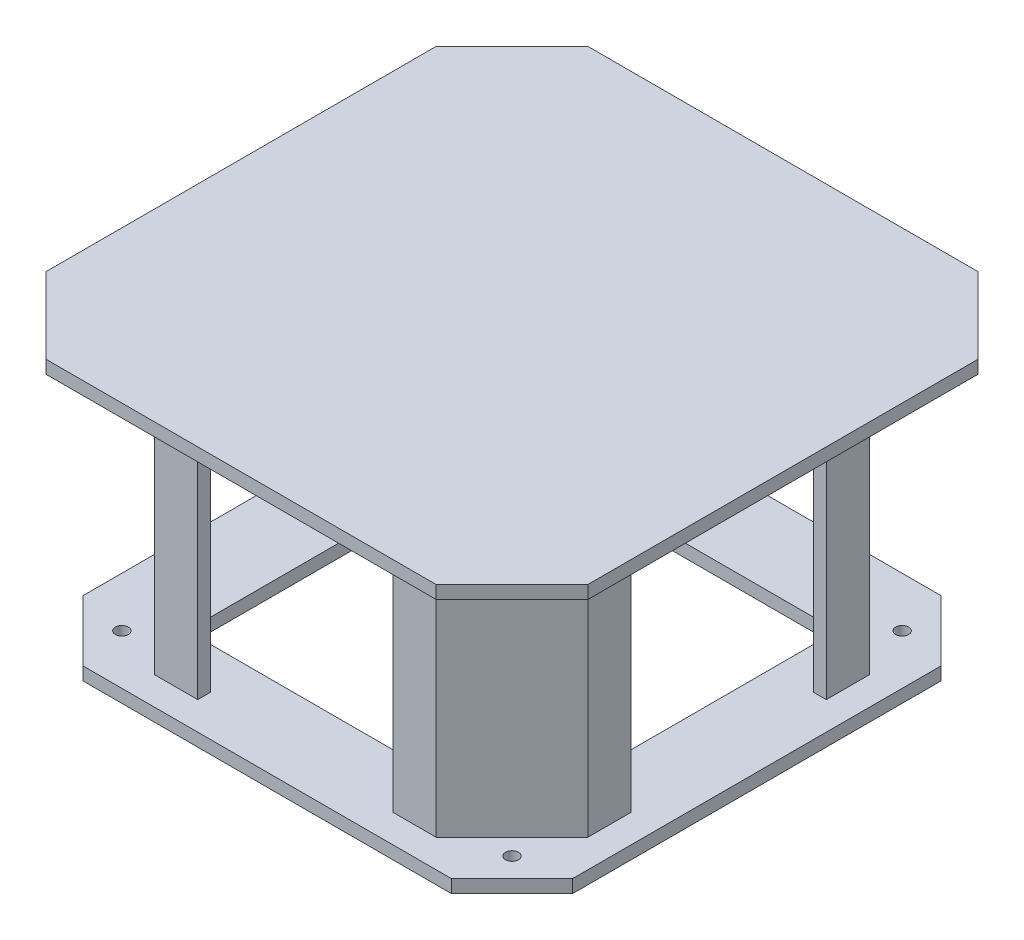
SolidWorks part; units mm, degrees
ref_plane "Front Plane" through (0, 0, 0) normal (0, 0, 1) x (1, 0, 0)
ref_plane "Top Plane" through (0, 0, 0) normal (0, 1, 0) x (1, 0, 0)
ref_plane "Right Plane" through (0, 0, 0) normal (1, 0, 0) x (0, 0, -1)
sketch "Sketch1" plane through (0, 0, 0) normal (0, 1, 0) x (1, 0, 0)
  line L1 (-125, -125) -> (125, -125)
  line L2 (-125, -125) -> (-125, 125)
  line L3 (-125, 125) -> (125, 125)
  line L4 (125, -125) -> (125, 125)
  line L5 (-125, -125) -> (125, 125) construction
  line L6 (-125, 125) -> (125, -125) construction
  point P0 (0, 0)
  dimension "D1" = 250
extrude "Boss-Extrude1" add sketch "Sketch1" along normal blind 6
chamfer "Chamfer1" distance 35 angle 45 4 edges at (-125, 3, -125) (125, 3, -125) (125, 3, 125) (-125, 3, 125)
sketch "Sketch3" plane through (0, 0, 0) normal (0, -1, 0) x (1, 0, 0)
  line L0 (-100, 65) -> (-65, 100)
  line L1 (-65, -100) -> (-45, -100)
  line L2 (-100, -65) -> (-100, -45)
  line L3 (-65, 100) -> (-45, 100)
  line L4 (100, -65) -> (100, -45)
  line L5 (-94, 45) -> (-94, 62.5147)
  line L6 (-94, 62.5147) -> (-62.5147, 94)
  line L7 (-100, -65) -> (-65, -100)
  line L8 (65, -100) -> (100, -65)
  line L9 (65, 100) -> (100, 65)
  line L10 (-100, 45) -> (-100, 65)
  line L11 (-62.5147, 94) -> (-45, 94)
  line L12 (-94, -62.5147) -> (-94, -45)
  line L13 (-94, -62.5147) -> (-62.5147, -94)
  line L14 (-62.5147, -94) -> (-45, -94)
  line L15 (45, -94) -> (62.5147, -94)
  line L16 (62.5147, -94) -> (94, -62.5147)
  line L17 (94, -62.5147) -> (94, -45)
  line L18 (45, 94) -> (62.5147, 94)
  line L19 (62.5147, 94) -> (94, 62.5147)
  line L20 (94, 45) -> (94, 62.5147)
  line L21 (-100, 45) -> (-94, 45)
  line L22 (-45, 100) -> (-45, 94)
  line L23 (45, 100) -> (45, 94)
  line L24 (94, 45) -> (100, 45)
  line L25 (100, 45) -> (100, 65)
  line L26 (94, -45) -> (100, -45)
  line L27 (45, 100) -> (65, 100)
  line L28 (45, -94) -> (45, -100)
  line L29 (45, -100) -> (65, -100)
  line L30 (-45, -100) -> (-45, -94)
  line L31 (-100, -45) -> (-94, -45)
  point P0 (0, 0)
  point P14 (0, 0)
  point P19 (0, 0)
  dimension "D1" = 20
  dimension "D2" = 100
  dimension "D3" = 100
  dimension "D4" = 35
  dimension "D5" = 35
  dimension "D6" = 100
  dimension "D7" = 100
  dimension "D8" = 35
  dimension "D9" = 6
  dimension "D10" = 6
  dimension "D11" = 6
  dimension "D12" = 6
extrude "Boss-Extrude2" add sketch "Sketch3" along normal blind 120
sketch "Sketch4" plane through (0, -120, 0) normal (0, -1, 0) x (1, 0, 0)
  line L44 (113, 85.0294) -> (85.0294, 113)
  line L45 (113, -85.0294) -> (113, 85.0294)
  line L46 (85.0294, -113) -> (113, -85.0294)
  line L47 (-85.0294, -113) -> (85.0294, -113)
  line L48 (-113, -85.0294) -> (-85.0294, -113)
  line L49 (-113, 85.0294) -> (-113, -85.0294)
  line L50 (-85.0294, 113) -> (-113, 85.0294)
  line L51 (85.0294, 113) -> (-85.0294, 113)
  line L52 (113, 85.0294) -> (85.0294, 113)
  line L53 (113, -85.0294) -> (113, 85.0294)
  line L54 (85.0294, -113) -> (113, -85.0294)
  line L55 (-85.0294, -113) -> (85.0294, -113)
  line L56 (-113, -85.0294) -> (-85.0294, -113)
  line L57 (-113, 85.0294) -> (-113, -85.0294)
  line L58 (-85.0294, 113) -> (-113, 85.0294)
  line L59 (85.0294, 113) -> (-85.0294, 113)
  dimension "D1" = 12
extrude "Boss-Extrude3" add sketch "Sketch4" along normal blind 6
sketch "Sketch5" plane through (0, -126, 0) normal (0, -1, 0) x (1, 0, 0)
  line L44 (75, 69.2893) -> (69.2893, 75)
  line L45 (75, -69.2893) -> (75, 69.2893)
  line L46 (69.2893, -75) -> (75, -69.2893)
  line L47 (-69.2893, -75) -> (69.2893, -75)
  line L48 (-75, -69.2893) -> (-69.2893, -75)
  line L49 (-75, 69.2893) -> (-75, -69.2893)
  line L50 (-69.2893, 75) -> (-75, 69.2893)
  line L51 (69.2893, 75) -> (-69.2893, 75)
  line L52 (75, 69.2893) -> (69.2893, 75)
  line L53 (75, -69.2893) -> (75, 69.2893)
  line L54 (69.2893, -75) -> (75, -69.2893)
  line L55 (-69.2893, -75) -> (69.2893, -75)
  line L56 (-75, -69.2893) -> (-69.2893, -75)
  line L57 (-75, 69.2893) -> (-75, -69.2893)
  line L58 (-69.2893, 75) -> (-75, 69.2893)
  line L59 (69.2893, 75) -> (-69.2893, 75)
  dimension "D1" = 38
extrude "Cut-Extrude2" cut sketch "Sketch5" against normal up to next
sketch "Sketch6" plane through (0, -120, 0) normal (0, 1, 0) x (1, 0, 0)
  circle A0 centre (-90, -90) radius 3
  circle A1 centre (90, -90) radius 3
  circle A2 centre (90, 90) radius 3
  circle A3 centre (-90, 90) radius 3
  dimension "D1" = 6
  dimension "D4" = 180
  dimension "D2" = 90
  dimension "D3" = 90
  dimension "D5" = 90
  dimension "D6" = 90
extrude "Cut-Extrude3" cut sketch "Sketch6" against normal up to next
